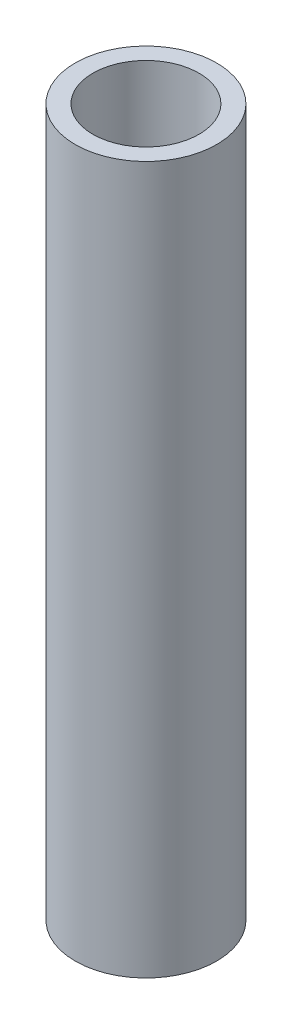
SolidWorks part; units mm, degrees
ref_plane "Plan de face" through (0, 0, 0) normal (0, 0, 1) x (1, 0, 0)
ref_plane "Plan de dessus" through (0, 0, 0) normal (0, 1, 0) x (1, 0, 0)
ref_plane "Plan de droite" through (0, 0, 0) normal (1, 0, 0) x (0, 0, -1)
sketch "Esquisse1" plane through (0, 0, 0) normal (0, 1, 0) x (1, 0, 0)
  circle A0 centre (0, 0) radius 20
  circle A1 centre (0, 0) radius 15
  dimension "D1" = 40
  dimension "D2" = 30
extrude "Boss.-Extru.1" add sketch "Esquisse1" along normal blind 200
